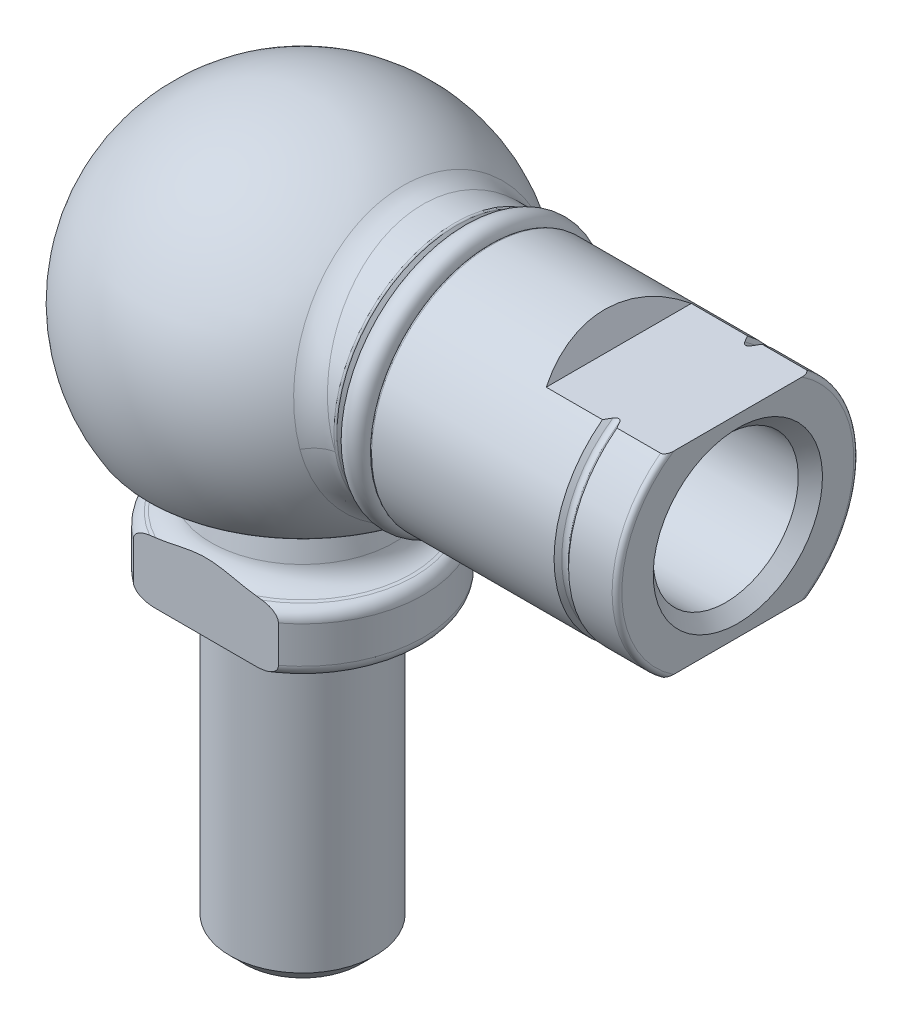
SolidWorks part; units mm, degrees
ref_plane "Plan de face" through (0, 0, 0) normal (0, 0, 1) x (1, 0, 0)
ref_plane "Plan de dessus" through (0, 0, 0) normal (0, 1, 0) x (1, 0, 0)
ref_plane "Plan de droite" through (0, 0, 0) normal (1, 0, 0) x (0, 0, -1)
sketch "Esquisse1" plane through (0, 0, 0) normal (0, 0, 1) x (1, 0, 0)
  line L0 (0, 0) -> (1.5011, 2.6)
  line L1 (1.5011, 2.6) -> (3.5011, 2.6)
  line L2 (3.5011, 2.6) -> (3.9011, 3)
  line L3 (3.9011, 3) -> (11.4011, 3)
  line L4 (11.9011, 3.5) -> (11.9011, 4.8)
  line L5 (11.7011, 5) -> (9.9011, 5)
  line L6 (1.6655, 4.95) -> (1.4346, 4.55)
  line L7 (0.592, 4.5132) -> (0.281, 4.9574)
  line L8 (0.1991, 5) -> (-1.5989, 5)
  line L9 (-6.0989, 6.5) -> (-6.0989, -1) construction
  line L10 (-6.0989, 0) -> (-1.0989, 0) construction
  line L11 (11.4011, 3) -> (11.9011, 3.5)
  line L12 (-1.0989, 0) -> (0, 0)
  line L13 (-1.5989, 5) -> (-1.5989, 2.1794)
  line L14 (9.9011, 5) -> (9.7425, 4.8414)
  line L15 (9.4597, 4.8414) -> (9.3011, 5)
  line L16 (9.3011, 5) -> (1.7521, 5)
  circle A0 centre (-6.0989, -1) radius 7.5 construction
  arc A1 (1.4346, 4.55) -> (0.592, 4.5132) centre (1.0015, 4.8) cw
  arc A2 (-1.0989, 0) -> (-1.5989, 2.1794) centre (-6.0989, 0) ccw
  arc A3 (1.7521, 5) -> (1.6655, 4.95) centre (1.7521, 4.9) ccw
  arc A4 (0.281, 4.9574) -> (0.1991, 5) centre (0.1991, 4.9) ccw
  arc A5 (11.9011, 4.8) -> (11.7011, 5) centre (11.7011, 4.8) ccw
  arc A6 (9.7425, 4.8414) -> (9.4597, 4.8414) centre (9.6011, 4.9828) cw
  point P5 (11.9011, 3)
  point P23 (0.2511, 5)
  point P33 (9.6011, 4.7)
  dimension "D2" = 15
  dimension "D10" = 0.5
  dimension "D17" = 10
  dimension "D18" = 0.1
  dimension "D19" = 0.2
  dimension "D24" = 0.2
  dimension "D1" = 6.5
  dimension "D3" = 120
  dimension "D4" = 45
  dimension "D5" = 0.4
  dimension "D6" = 3
  dimension "D7" = 5
  dimension "D8" = 8
  dimension "D9" = 2
  dimension "D11" = 120
  dimension "D12" = 35
  dimension "D13" = 0.2
  dimension "D14" = 30
  dimension "D15" = 18
  dimension "D16" = 1.85
  dimension "D20" = 0.3
  dimension "D21" = 45
  dimension "D23" = 2.3
revolve "Révolution1" add sketch "Esquisse1" angle 360 about L10
sketch "Esquisse2" plane through (0, 0, 0) normal (0, 0, 1) x (1, 0, 0)
  line L0 (-6.0989, 6.5) -> (-6.0989, -1) construction
  line L1 (-1.0989, 0) -> (-1.0989, -1.3)
  line L2 (-0.4989, -5) -> (0.19, -5)
  line L3 (-1.0989, -1.3) -> (-0.0989, -1.3)
  line L4 (-0.0989, -1.3) -> (-0.0989, -2.3)
  line L5 (-0.0989, -2.3) -> (-0.5989, -2.3)
  line L6 (-0.5989, -2.3) -> (-0.5989, -4.9)
  line L7 (-6.0989, 5) -> (-6.0989, 6.5)
  circle A0 centre (-6.0989, -1) radius 7.5 construction
  arc A1 (0.275, -4.9527) -> (-6.0989, 6.5) centre (-6.0989, -1) ccw
  arc A2 (-1.0989, 0) -> (-1.5989, 2.1794) centre (-6.0989, 0) ccw construction
  arc A3 (-1.0989, 0) -> (-6.0989, 5) centre (-6.0989, 0) ccw
  arc A4 (0.19, -5) -> (0.275, -4.9527) centre (0.19, -4.9) ccw
  arc A5 (-0.5989, -4.9) -> (-0.4989, -5) centre (-0.4989, -4.9) ccw
  dimension "D5" = 0.1
  dimension "D1" = 5.5
  dimension "D2" = 1
  dimension "D3" = 1.3
  dimension "D4" = 0.5
revolve "Révolution2" add sketch "Esquisse2" angle 360 about L0
fillet "Congé1" radius 1.5 7 edges at (0.2467, -4.9728, -0.3883) (0.2346, -4.9866, 0.262) (0.2417, -4.9288, 0.782) (-1.5947, 4.9812, 0.433)
sketch "Esquisse4" plane through (0, 0, 0) normal (0, 0, 1) x (1, 0, 0)
  line L0 (-0.4989, -5) -> (0.19, -5) construction
  line L2 (-1.0989, 0) -> (-1.0989, -1.3) construction
  line L3 (-1.0989, -1.3) -> (-0.0989, -1.3) construction
  line L4 (-0.0989, -1.3) -> (-0.0989, -2.3) construction
  line L5 (-0.0989, -2.3) -> (-0.5989, -2.3) construction
  line L6 (-0.5989, -2.3) -> (-0.5989, -4.9) construction
  line L7 (-0.4989, -5) -> (0.19, -5)
  line L8 (0.19, -5) -> (0.19, -6.1991)
  line L9 (-1.0989, 0) -> (-1.0989, -1.3)
  line L10 (-1.0989, -1.3) -> (-0.0989, -1.3)
  line L11 (-0.0989, -1.3) -> (-0.0989, -2.3)
  line L12 (-0.0989, -2.3) -> (-0.5989, -2.3)
  line L13 (-0.5989, -2.3) -> (-0.5989, -4.9)
  line L14 (0.19, -6.1991) -> (-6.0989, -6.1991)
  line L15 (-6.0989, -6.1991) -> (-6.0989, 5)
  arc A2 (-1.0989, 0) -> (-6.0989, 5) centre (-6.0989, 0) ccw construction
  arc A3 (-0.5989, -4.9) -> (-0.4989, -5) centre (-0.4989, -4.9) ccw construction
  arc A6 (-1.0989, 0) -> (-6.0989, 5) centre (-6.0989, 0) ccw
  arc A7 (-0.5989, -4.9) -> (-0.4989, -5) centre (-0.4989, -4.9) ccw
revolve "Enlèvement de matière-Révolution1" cut sketch "Esquisse4" angle 360 about L15
sketch "Esquisse5" plane through (0, 0, 0) normal (0, 0, 1) x (1, 0, 0)
  line L0 (-6.0989, 5) -> (-6.0989, -23.5)
  line L1 (-6.0989, -23.5) -> (-8.4989, -23.5)
  line L2 (-9.0989, -22.9) -> (-9.0989, -15.6)
  line L6 (-9.0989, -15.6) -> (-9.0989, -11)
  line L7 (-9.0989, -11) -> (-10.5989, -11)
  line L8 (-11.0989, -10.5) -> (-11.0989, -8.9837)
  line L9 (-10.7283, -8.5007) -> (-10.6068, -8.4682)
  line L10 (-9.8875, -7.7101) -> (-9.1631, -4.3021)
  line L11 (-8.4989, -23.5) -> (-9.0989, -22.9)
  arc A0 (-6.0989, 5) -> (-9.3291, -3.8165) centre (-6.0989, 0) ccw
  arc A1 (-11.0989, -8.9837) -> (-10.7283, -8.5007) centre (-10.5989, -8.9837) cw
  arc A2 (-10.6068, -8.4682) -> (-9.8875, -7.7101) centre (-10.8657, -7.5022) ccw
  arc A3 (-9.3291, -3.8165) -> (-9.1631, -4.3021) centre (-9.6522, -4.1981) cw
  arc A5 (-10.5989, -11) -> (-11.0989, -10.5) centre (-10.5989, -10.5) cw
  point P6 (-9.0989, -23.5)
  point P17 (-11.0989, -8.6)
  point P22 (-9.0989, -4)
  point P28 (-11.0989, -11)
  dimension "D14" = 0.5
  dimension "D15" = 1
  dimension "D16" = 0.5
  dimension "D17" = 0.5
  dimension "D1" = 11
  dimension "D2" = 12.5
  dimension "D3" = 15
  dimension "D4" = 12
  dimension "D5" = 5
  dimension "D6" = 2.4
  dimension "D9" = 4.6
  dimension "D10" = 3
  dimension "D12" = 5
  dimension "D13" = 3
revolve "Révolution3" add sketch "Esquisse5" angle 360 about L0
sketch "Esquisse7" plane through (0, -11, 0) normal (0, -1, 0) x (1, 0, 0)
  line L0 (1.4011, 0) -> (-13.5989, 0) construction
  line L1 (-20.9645, 14.0673) -> (2.1599, 14.0673)
  line L2 (-20.9645, 14.0673) -> (-20.9645, 4)
  line L3 (-20.9645, 4) -> (2.1599, 4)
  line L4 (2.1599, 14.0673) -> (2.1599, 4)
  line L5 (2.1599, -4) -> (-22.2513, -4)
  line L6 (2.1599, -4) -> (2.1599, -9.1093)
  line L7 (2.1599, -9.1093) -> (-22.2513, -9.1093)
  line L8 (-22.2513, -4) -> (-22.2513, -9.1093)
  dimension "D1" = 4
  dimension "D2" = 8
extrude "Enlèv. mat.-Extru.2" cut sketch "Esquisse7" against normal blind 5.5
sketch "Esquisse8" plane through (11.9011, 0, 0) normal (1, 0, 0) x (0, 0, -1)
  line L1 (-11.2801, -4) -> (12.1843, -4)
  line L2 (-11.2801, -4) -> (-11.2801, -10.7364)
  line L3 (-11.2801, -10.7364) -> (12.1843, -10.7364)
  line L4 (12.1843, -4) -> (12.1843, -10.7364)
  line L13 (-8.8839, 7.21) -> (7.392, 7.21)
  line L14 (-8.8839, 7.21) -> (-8.8839, 4)
  line L15 (-8.8839, 4) -> (7.392, 4)
  line L16 (7.392, 7.21) -> (7.392, 4)
  dimension "D2" = 8
extrude "Enlèv. mat.-Extru.3" cut sketch "Esquisse8" against normal blind 5.5
chamfer "Chanfrein1" distance 1 angle 30 2 edges at (6.4011, 4, 0) (6.4011, -4, 0)
sketch "Esquisse9" plane through (0, 0, 0) normal (0, 0, 1) x (1, 0, 0)
  circle A0 centre (1.0015, 4.8) radius 0.5
revolve "Révolution4" add sketch "Esquisse9" angle 360 about L12
sketch "Esquisse11" plane through (0, 0, 0) normal (0, 0, 1) x (1, 0, 0)
  line L6 (-6.0989, -11) -> (-6.0989, -19.1923) construction
  line L7 (-8.1604, -11) -> (-4.0373, -11) construction
  line L9 (-0.0989, -1.3) -> (-1.2708, -1.3)
  line L10 (-0.0989, -1.3) -> (-0.0989, -2.3)
  line L11 (-0.0989, -2.3) -> (-1.3418, -2.3)
  arc A2 (-1.5248, -2.0192) -> (-1.2708, -1.3) centre (-6.0989, 0) ccw
  arc A3 (-1.5248, -2.0192) -> (-1.3418, -2.3) centre (-1.3418, -2.1) ccw
  dimension "D5" = 0.2
  dimension "D4" = 1
revolve "Révolution5" add sketch "Esquisse11" angle 360 about L6
